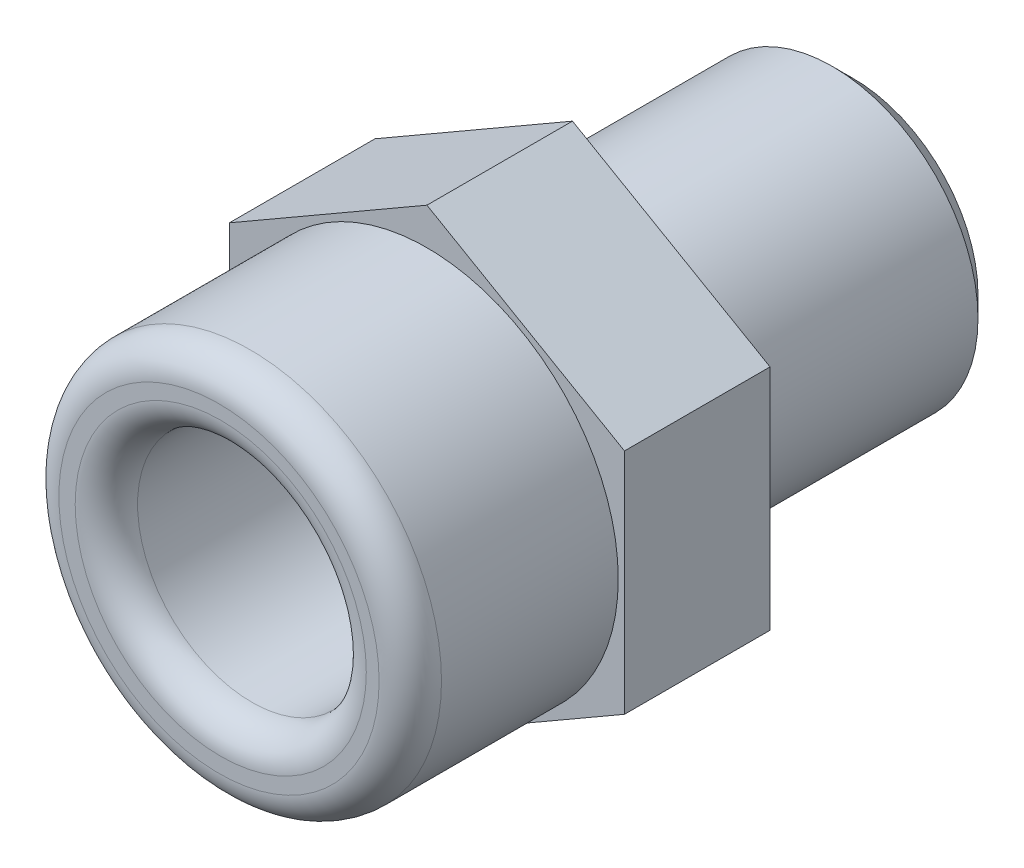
SolidWorks part; units mm, degrees
ref_plane "Plan1" through (0, 0, 0) normal (0, 0, 1) x (1, 0, 0)
ref_plane "Plan2" through (0, 0, 0) normal (0, 1, 0) x (1, 0, 0)
ref_plane "Plan3" through (0, 0, 0) normal (1, 0, 0) x (0, 0, -1)
sketch "Esquisse1" plane through (0, 0, 0) normal (0, 0, 1) x (1, 0, 0)
  line L1 (0, -10.9697) -> (9.5, -5.4848)
  line L2 (9.5, -5.4848) -> (9.5, 5.4848)
  line L3 (9.5, 5.4848) -> (0, 10.9697)
  line L4 (0, 10.9697) -> (-9.5, 5.4848)
  line L5 (-9.5, 5.4848) -> (-9.5, -5.4848)
  line L6 (-9.5, -5.4848) -> (0, -10.9697)
  circle A0 centre (0, 0) radius 9.5 construction
  dimension "D1" = 19
extrude "Base-Extrusion" add sketch "Esquisse1" along normal blind 7
sketch "Esquisse2" plane through (0, 0, 7) normal (0, 0, 1) x (1, 0, 0)
  circle A0 centre (0, 0) radius 9.2
  dimension "D1" = 18.4
extrude "Boss.-Extru.1" add sketch "Esquisse2" along normal blind 10
sketch "Esquisse3" plane through (0, 0, 0) normal (0, 0, -1) x (-1, 0, 0)
  circle A0 centre (0, 0) radius 7
  dimension "D1" = 14
extrude "Boss.-Extru.2" add sketch "Esquisse3" along normal blind 13.5
chamfer "Chanfrein1" distance 1 angle 45
sketch "Esquisse4" plane through (0, 0, 17) normal (0, 0, 1) x (1, 0, 0)
  circle A0 centre (0.0839, 0.0559) radius 5.5
  dimension "D1" = 11
extrude "Enlèv. mat.-Extru.1" cut sketch "Esquisse4" against normal blind 12.8
sketch "Esquisse5" plane through (0, 0, -13.5) normal (0, 0, -1) x (-1, 0, 0)
  circle A0 centre (0, 0) radius 5.75
  dimension "D1" = 11.5
extrude "Enlèv. mat.-Extru.2" cut sketch "Esquisse5" against normal blind 13
sketch "Esquisse6" plane through (0, 0, -0.5) normal (0, 0, -1) x (-1, 0, 0)
  circle A0 centre (0, 0) radius 3.5
  dimension "D1" = 7
extrude "Enlèv. mat.-Extru.3" cut sketch "Esquisse6" against normal through all
fillet "Congé1" radius 1.5
